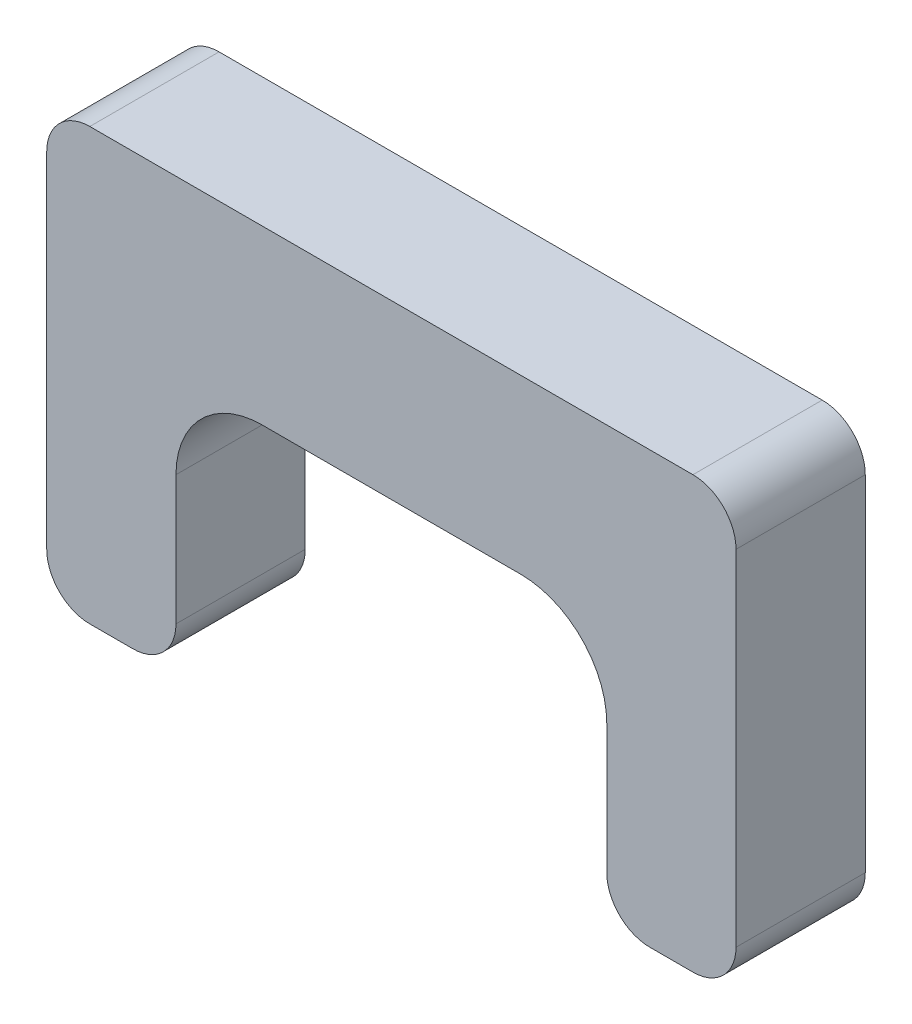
SolidWorks part; units mm, degrees
ref_plane "前视基准面" through (0, 0, 0) normal (0, 0, 1) x (1, 0, 0)
ref_plane "上视基准面" through (0, 0, 0) normal (0, 1, 0) x (1, 0, 0)
ref_plane "右视基准面" through (0, 0, 0) normal (1, 0, 0) x (0, 0, -1)
sketch "草图1" plane through (0, 0, 0) normal (0, 0, 1) x (1, 0, 0)
  line L1 (-8, 5) -> (8, 5)
  line L2 (-8, 5) -> (-8, -5)
  line L3 (-8, -5) -> (8, -5)
  line L4 (8, 5) -> (8, -5)
  line L5 (-8, 5) -> (8, -5) construction
  line L6 (-8, -5) -> (8, 5) construction
  point P0 (0, 0)
  dimension "D1" = 10
  dimension "D2" = 16
extrude "凸台-拉伸1" add sketch "草图1" along normal blind 3
sketch "草图2" plane through (0, 0, 3) normal (0, 0, 1) x (1, 0, 0)
  line L0 (-8, -5) -> (8, -5) construction
  line L1 (-5, -11) -> (5, -11)
  line L2 (-5, -11) -> (-5, 1)
  line L3 (-5, 1) -> (5, 1)
  line L4 (5, -11) -> (5, 1)
  line L5 (-5, -11) -> (5, 1) construction
  line L6 (-5, 1) -> (5, -11) construction
  point P0 (0, -5)
  dimension "D1" = 10
  dimension "D2" = 6
extrude "切除-拉伸1" cut sketch "草图2" against normal blind 3
fillet "圆角1" radius 2 2 edges at (-5, 1, 1.5) (5, 1, 1.5)
fillet "圆角2" radius 1 6 edges at (-5, -5, 1.5) (-8, -5, 1.5) (-8, 5, 1.5) (8, -5, 1.5) (5, -5, 1.5) (8, 5, 1.5)
